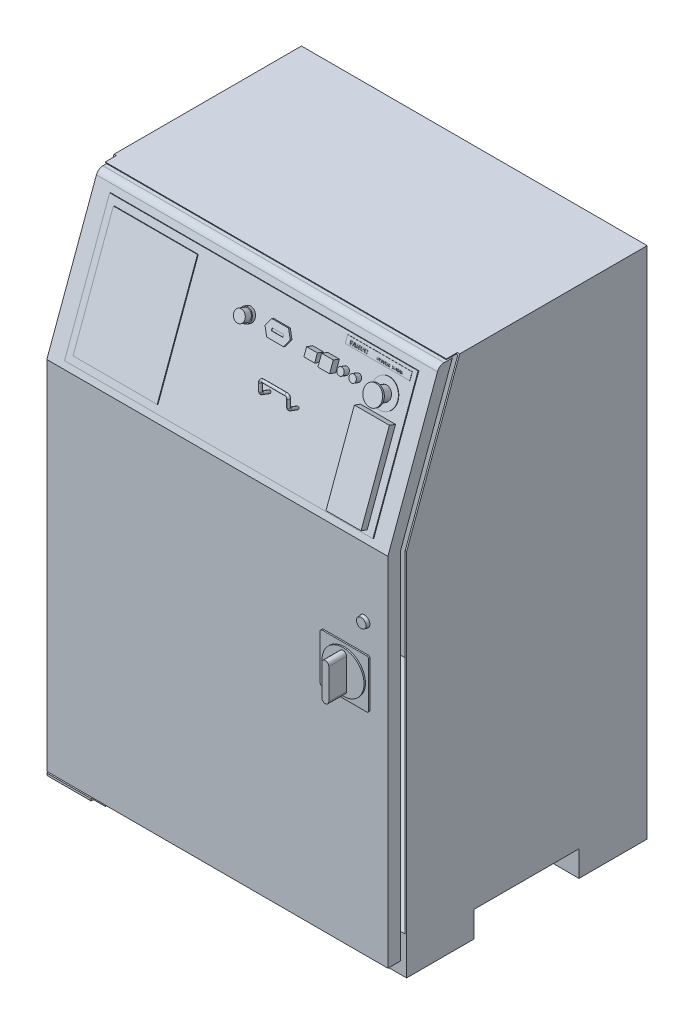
SolidWorks part; units mm, degrees
ref_plane "Plan de face" through (0, 0, 0) normal (0, 0, 1) x (1, 0, 0)
ref_plane "Plan de dessus" through (0, 0, 0) normal (0, 1, 0) x (1, 0, 0)
ref_plane "Plan de droite" through (0, 0, 0) normal (1, 0, 0) x (0, 0, -1)
imported_body "Importée1"
imported_body "Importée2"
sketch "Esquisse1" plane through (-370, 0, 0) normal (-1, 0, 0) x (0, 0, 1)
  line L0 (240, 790.2743) -> (240, 0) construction
  line L1 (-275, 1100) -> (-275, 0) construction
  line L2 (240, 0) -> (96, 0) construction
  line L3 (-129, 0) -> (-275, 0) construction
  point P0 (200, 705)
  point P1 (-130, 705)
  point P2 (-130, 410)
  point P3 (200, 410)
  point P4 (200, 115)
  point P5 (-130, 115)
  dimension "D1" = 40
  dimension "D2" = 40
  dimension "D3" = 40
  dimension "D4" = 145
  dimension "D5" = 145
  dimension "D6" = 145
  dimension "D7" = 115
  dimension "D8" = 115
  dimension "D9" = 295
  dimension "D10" = 295
  dimension "D11" = 295
  dimension "D12" = 295
hole_wizard "Dégagement M51" positions "Esquisse3D3" profile "Esquisse4" hole size "M5" standard "ISO"
sketch3d "Esquisse3D3"
  point P0 (-370, 115, -130)
  point P3 (-370, 410, -130)
sketch "Esquisse4" plane through (-370, 115, -130) normal (0, 1, 0) x (0, 0, 1)
  line L0 (0, 0) -> (0, 11.6524)
  line L1 (0, 11.6524) -> (2.75, 10)
  line L2 (2.75, 10) -> (2.75, 0)
  line L5 (2.75, 0) -> (0, 0)
  line L10 (0, 11.6524) -> (-2.75, 10) construction
  line L11 (0, -6.35) -> (0, 107.95) construction
  dimension "Diamètre du perçage" = 5.5
  dimension "Profondeur du perçage" = 10
  dimension "Angle de pointe" = 118
hole_wizard "Dégagement M52" positions "Esquisse3D4" profile "Esquisse5" hole size "M5" standard "ISO"
sketch3d "Esquisse3D4"
  point P0 (-370, 115, 200)
  point P3 (-370, 410, 200)
  point P6 (-370, 705, 200)
  point P9 (-370, 705, -130)
sketch "Esquisse5" plane through (-370, 115, 200) normal (0, 1, 0) x (0, 0, 1)
  line L0 (0, 0) -> (0, 11.6524)
  line L1 (0, 11.6524) -> (2.75, 10)
  line L2 (2.75, 10) -> (2.75, 0)
  line L5 (2.75, 0) -> (0, 0)
  line L10 (0, 11.6524) -> (-2.75, 10) construction
  line L11 (0, -6.35) -> (0, 107.95) construction
  dimension "Diamètre du perçage" = 5.5
  dimension "Profondeur du perçage" = 10
  dimension "Angle de pointe" = 118
